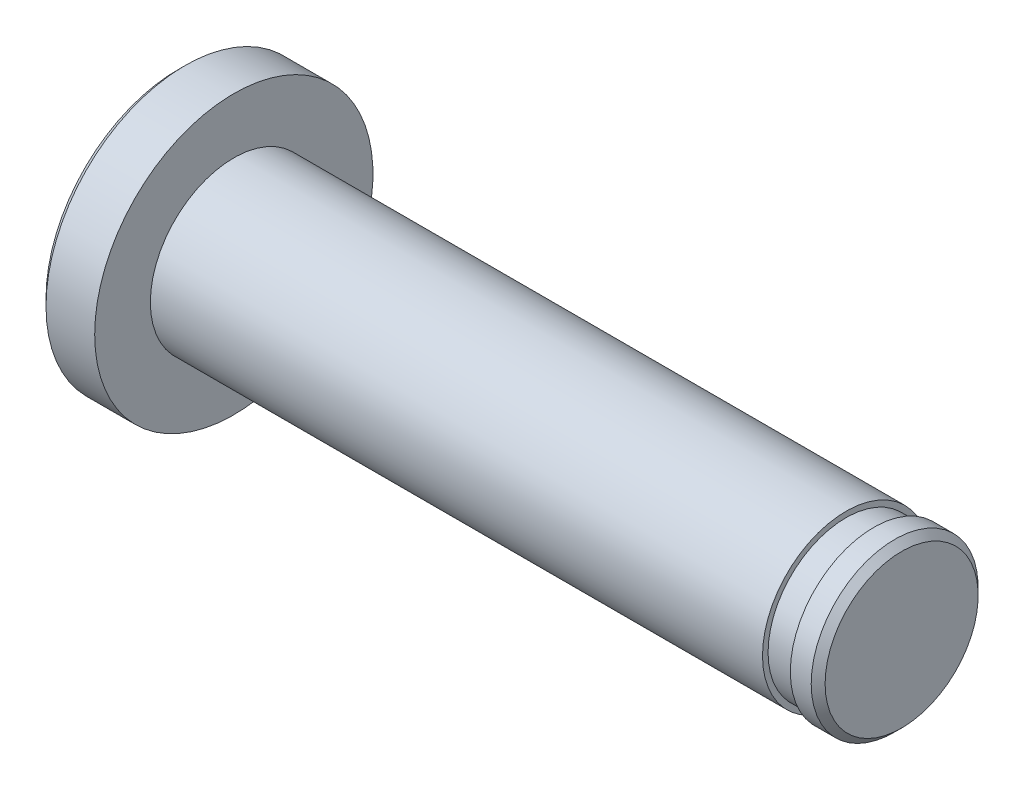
SolidWorks part; units mm, degrees
ref_plane "Plan1" through (0, 0, 0) normal (0, 0, 1) x (1, 0, 0)
ref_plane "Plan2" through (0, 0, 0) normal (0, 1, 0) x (1, 0, 0)
ref_plane "Plan3" through (0, 0, 0) normal (1, 0, 0) x (0, 0, -1)
sketch "Esquisse1" plane through (0, 0, 0) normal (0, 0, 1) x (1, 0, 0)
  line L0 (0, 0) -> (72, 0) construction
  line L1 (-2, 0) -> (-2, 4.75)
  line L2 (-1.75, 5) -> (0, 5)
  line L3 (0, 5) -> (0, 3)
  line L4 (0, 3) -> (22, 3)
  line L5 (22, 3) -> (22, 2.8)
  line L6 (22, 2.8) -> (23, 2.8)
  line L7 (23, 2.8) -> (23, 3)
  line L8 (23, 3) -> (23.75, 3)
  line L9 (24, 2.75) -> (24, 0)
  line L10 (24, 0) -> (-2, 0)
  line L11 (-2, 4.75) -> (-1.75, 5)
  line L12 (23.75, 3) -> (24, 2.75)
  point P4 (-2, 5)
  point P11 (24, 3)
  dimension "D1" = 6
  dimension "D2" = 1
  dimension "D5" = 5.6
  dimension "D6" = 22
  dimension "D7" = 2
  dimension "D8" = 10
  dimension "D9" = 1
revolve "Base-Révolution" add sketch "Esquisse1" angle 360 about L0
